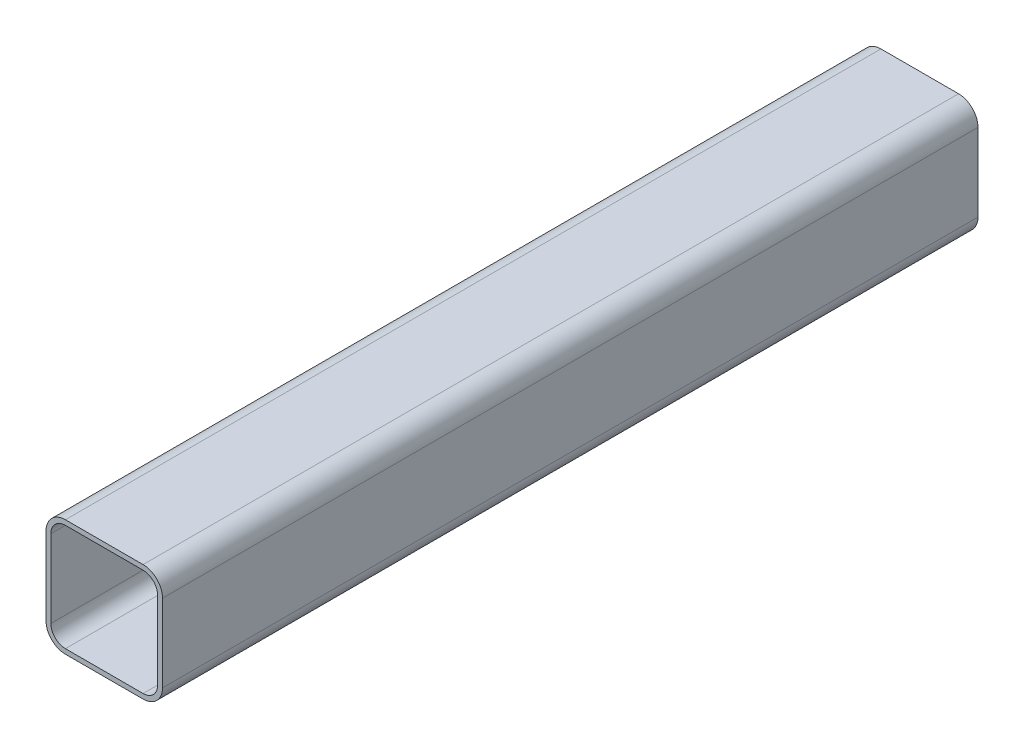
SolidWorks part; units mm, degrees
ref_plane "Front" through (0, 0, 0) normal (0, 0, 1) x (1, 0, 0)
ref_plane "Top" through (0, 0, 0) normal (0, 1, 0) x (1, 0, 0)
ref_plane "Right" through (0, 0, 0) normal (1, 0, 0) x (0, 0, -1)
sketch "Sketch1" plane through (0, 0, 0) normal (0, 0, 1) x (1, 0, 0)
  line L0 (-25.4, 38.1) -> (25.4, 38.1)
  line L1 (-38.1, 25.4) -> (-38.1, -25.4)
  line L2 (25.4, -38.1) -> (-25.4, -38.1)
  line L3 (38.1, -25.4) -> (38.1, 25.4)
  line L4 (0, 38.1) -> (0, -38.1) construction
  arc A0 (38.1, 25.4) -> (25.4, 38.1) centre (25.4, 25.4) ccw
  arc A1 (38.1, -25.4) -> (25.4, -38.1) centre (25.4, -25.4) cw
  arc A2 (-25.4, -38.1) -> (-38.1, -25.4) centre (-25.4, -25.4) cw
  arc A3 (-38.1, 25.4) -> (-25.4, 38.1) centre (-25.4, 25.4) cw
  dimension "D1" = 12.7
  dimension "D2" = 76.2
  dimension "D3" = 76.2
extrude "Base-Extrude-Thin" add sketch "Sketch1" along normal blind 533.4 thin
